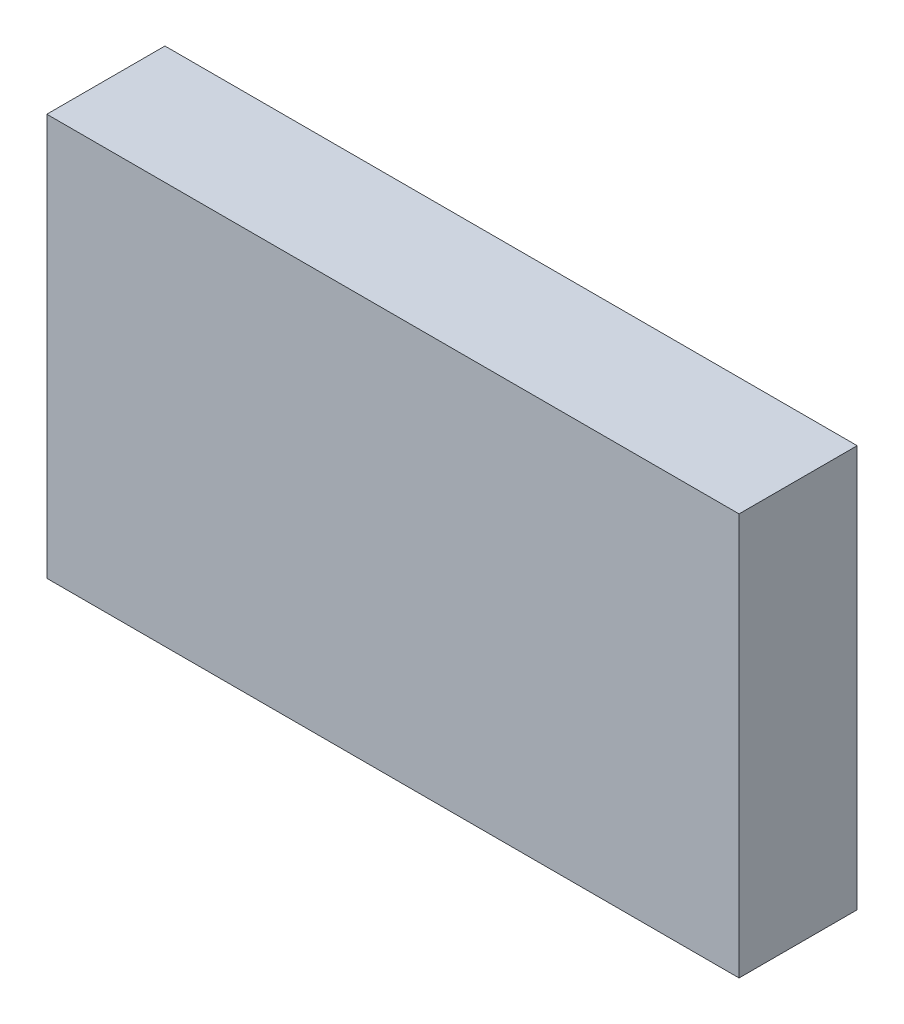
SolidWorks part; units mm, degrees
ref_plane "Front Plane" through (0, 0, 0) normal (0, 0, 1) x (1, 0, 0)
ref_plane "Top Plane" through (0, 0, 0) normal (0, 1, 0) x (1, 0, 0)
ref_plane "Right Plane" through (0, 0, 0) normal (1, 0, 0) x (0, 0, -1)
sketch "GENERAL" plane through (0, 0, 0) normal (0, 0, 1) x (1, 0, 0)
  line L16 (-7.7597, -4.2037) -> (7.1247, -4.2037)
  line L17 (7.1247, -4.2037) -> (7.1247, 4.4385)
  line L18 (7.1247, 4.4385) -> (-7.7597, 4.4385)
  line L19 (-7.7597, 4.4385) -> (-7.7597, -4.2037)
extrude "Boss-Extrude1" add sketch "GENERAL" along normal blind 2.54
